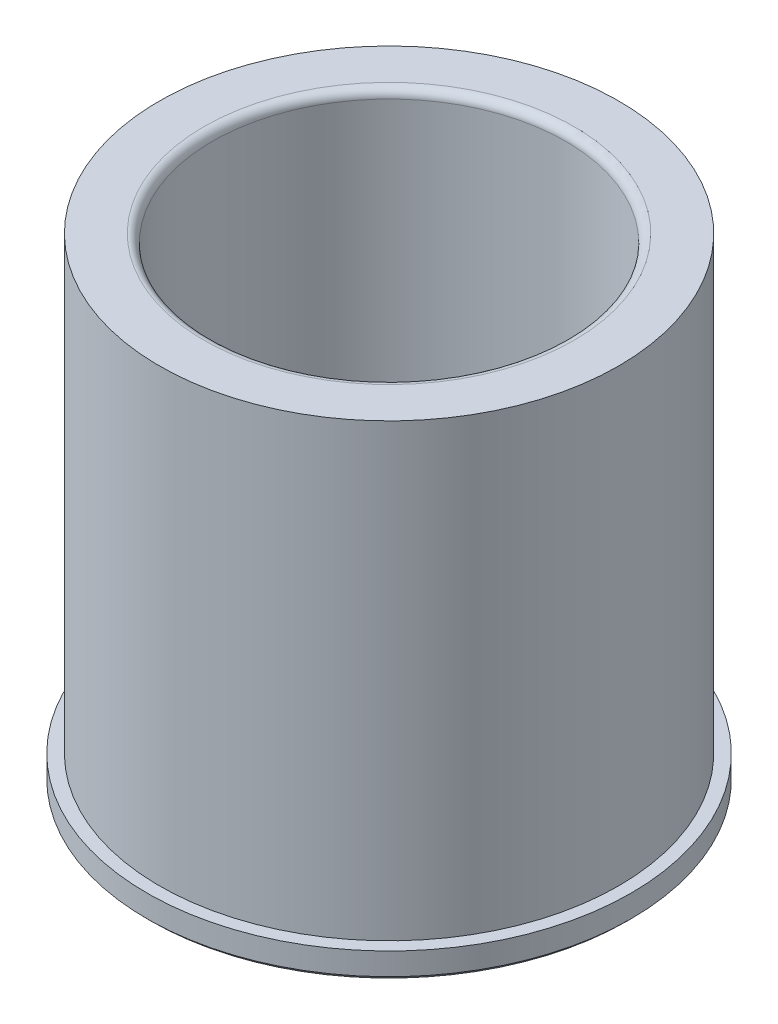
SolidWorks part; units mm, degrees
ref_plane "Front Plane" through (0, 0, 0) normal (0, 0, 1) x (1, 0, 0)
ref_plane "Top Plane" through (0, 0, 0) normal (0, 1, 0) x (1, 0, 0)
ref_plane "Right Plane" through (0, 0, 0) normal (1, 0, 0) x (0, 0, -1)
sketch "Sketch1" plane through (0, 0, 0) normal (0, 0, 1) x (1, 0, 0)
  line L0 (-42.7609, 0) -> (-43.5229, 0.762)
  line L1 (0, -1000) -> (0, 49000) construction
  line L2 (-31.7564, 85.725) -> (-31.7563, 0.762)
  line L3 (-32.5183, 0) -> (-42.7609, 0)
  line L4 (-43.5229, 0.762) -> (-43.5229, 4.7625)
  line L5 (-43.5229, 4.7625) -> (-41.2813, 4.7625)
  line L6 (-41.2814, 85.725) -> (-41.2813, 4.7625)
  line L7 (-41.2814, 85.725) -> (-31.7564, 85.725)
  line L8 (-32.5183, 0) -> (-31.7563, 0.762)
  dimension "OD" = 82.5627
  dimension "ID" = 63.5127
  dimension "H" = 87.0458
  dimension "D2" = 45
  dimension "OVERALL LENGTH" = 85.725
  dimension "D4" = 0.762
  dimension "D5" = 135
  dimension "T" = 4.7625
revolve "Revolve1" add sketch "Sketch1" angle 360 about L1
fillet "Fillet1" radius 1.524 1 edges at (31.7563, 85.725, 0)
